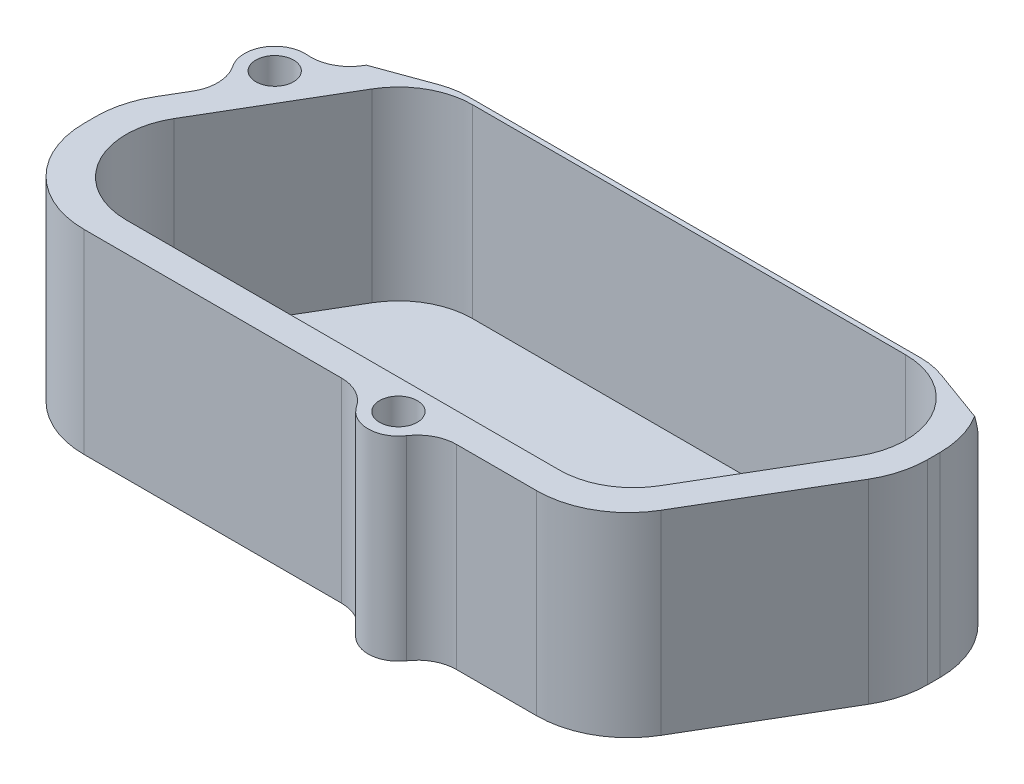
SolidWorks part; units mm, degrees
ref_plane "Front Plane" through (0, 0, 0) normal (0, 0, 1) x (1, 0, 0)
ref_plane "Top Plane" through (0, 0, 0) normal (0, 1, 0) x (1, 0, 0)
ref_plane "Right Plane" through (0, 0, 0) normal (1, 0, 0) x (0, 0, -1)
sketch "Sketch1" plane through (0, 0, 0) normal (0, 1, 0) x (1, 0, 0)
  line L0 (-28.2141, 0) -> (28.2141, 0)
  line L1 (36.5344, 4.7598) -> (46.0926, 21.0158)
  line L2 (-32.3971, 29.0976) -> (-30.1984, 32.837)
  line L3 (51.0344, 26.7749) -> (51.0344, 25.1592)
  line L4 (29.0733, -3.81) -> (15.0701, -3.81)
  line L5 (-41.8495, 9.7658) -> (-41.8495, 8.1501)
  line L6 (7.1972, -3.81) -> (-29.8894, -3.81)
  line L7 (39.3833, 2.088) -> (49.3843, 19.0971)
  line L11 (-40.1994, 15.8279) -> (-36.192, 22.6435)
  line L16 (-36.5344, 14.5442) -> (-26.9762, 30.8002)
  line L19 (-18.6559, 35.56) -> (37.7723, 35.56)
  line L23 (-19.8884, 38.735) -> (39.0743, 38.735)
  arc A0 (47.4239, 25.9953) -> (46.0926, 21.0158) centre (37.7723, 25.908) cw
  arc A1 (-37.8661, 9.652) -> (-36.5344, 14.5442) centre (-28.2141, 9.652) cw
  arc A2 (37.7723, 35.56) -> (47.4239, 25.9953) centre (37.7723, 25.908) cw
  arc A3 (-26.9762, 30.8002) -> (-18.6559, 35.56) centre (-18.6559, 25.908) cw
  arc A4 (36.5344, 4.7598) -> (28.2141, 0) centre (28.2141, 9.652) cw
  arc A5 (-37.8661, 9.652) -> (-28.2141, 0) centre (-28.2141, 9.652) ccw
  arc A6 (39.0743, 38.735) -> (51.0344, 26.7749) centre (39.0743, 26.7749) cw
  arc A7 (51.0344, 25.1592) -> (49.3843, 19.0971) centre (39.0743, 25.1592) cw
  arc A8 (39.3833, 2.088) -> (29.0733, -3.81) centre (29.0733, 8.1501) cw
  arc A9 (-29.8894, -3.81) -> (-41.8495, 8.1501) centre (-29.8894, 8.1501) cw
  arc A10 (-41.8495, 9.7658) -> (-40.1994, 15.8279) centre (-29.8894, 9.7658) cw
  arc A11 (-30.1984, 32.837) -> (-19.8884, 38.735) centre (-19.8884, 26.7749) cw
  circle A12 centre (11.1337, -3.8772) radius 2.0828 construction
  arc A14 (-32.3971, 29.0976) -> (-36.192, 22.6435) centre (-35.3452, 26.4883) ccw
  circle A15 centre (-35.3452, 26.4883) radius 2.0828 construction
  arc A16 (7.1972, -3.81) -> (15.0701, -3.81) centre (11.1337, -3.8772) ccw
  point P11 (47.4757, 23.368)
  point P18 (-37.8661, 12.192)
  point P35 (-37.8661, 0)
  point P45 (0, 0)
  dimension "D7" = 3.175
  dimension "D6" = 1.6157
  dimension "D11" = 9.652
  dimension "D12" = 0.7439
  dimension "D13" = 1.6157
  dimension "D14" = 3.937
  dimension "D2" = 67.9468
  dimension "D3" = 3.81
  dimension "D4" = 35.56
  dimension "D5" = 3.81
  dimension "D8" = 3.81
  dimension "D9" = 12.192
  dimension "D10" = 120.455
extrude "Boss-Extrude1" add sketch "Sketch1" along normal blind 25.4
hole_wizard "#10 (0.1935) Diameter Hole1" positions "Sketch2" profile "Sketch3" hole size "#10" standard "ANSI Inch"
sketch "Sketch2" plane through (0, 25.4, 0) normal (0, 1, 0) x (1, 0, 0)
  point P0 (-35.3452, 26.4883)
  point P3 (11.1337, -3.8772)
sketch "Sketch3" plane through (-35.3452, 25.4, -26.4883) normal (1, 0, 0) x (0, 0, 1)
  line L0 (0, 0) -> (0, 25.4)
  line L1 (0, 25.4) -> (2.4574, 25.4)
  line L2 (2.4574, 25.4) -> (2.4574, 0)
  line L5 (2.4574, 0) -> (0, 0)
  line L11 (0, -6.35) -> (0, 107.95) construction
  dimension "Thru Hole Dia." = 4.9149
  dimension "Thru Hole Depth" = 25.4
fillet "Fillet3" radius 5.08 4 edges at (15.0701, 12.7, 3.81) (7.1972, 12.7, 3.81) (-32.3971, 12.7, -29.0976) (-36.192, 12.7, -22.6435)
sketch "Sketch4" plane through (0, 25.4, 0) normal (0, 1, 0) x (1, 0, 0)
  line L0 (-23.979, 38.0137) -> (-35.9131, 33.6701)
  line L2 (43.1649, 38.0137) -> (55.099, 33.6701)
  line L3 (39.0743, 38.735) -> (-19.8884, 38.735)
  line L4 (39.0743, 38.735) -> (-19.8884, 38.735)
  arc A6 (51.0344, 26.7749) -> (39.0743, 38.735) centre (39.0743, 26.7749) ccw
  arc A7 (-19.8884, 38.735) -> (-30.1744, 32.8775) centre (-19.8884, 26.7749) ccw
  arc A8 (43.1649, 38.0137) -> (39.0743, 38.735) centre (39.0743, 26.7749) ccw
  arc A9 (-19.8884, 38.735) -> (-23.979, 38.0137) centre (-19.8884, 26.7749) ccw
  point P9 (-25.8251, 37.5287)
  point P10 (0, 0)
  point P11 (0, 0)
  point P12 (0, 0)
  point P14 (0, 0)
  dimension "D2" = 160
  dimension "D3" = 12.7
  dimension "D4" = 160
  dimension "D5" = 12.7
  dimension "D1" = 0
ref_plane "Plane1" through (55.099, 25.4, -33.6701) normal (-0.9397, 0, -0.342) x (-0.342, 0, 0.9397)
sketch "Sketch5" plane through (62.2552, 25.4, -53.3315) normal (-0.9397, 0, -0.342) x (-0.342, 0, 0.9397)
  line L0 (20.9233, 0) -> (23.4633, 0)
  line L3 (23.4633, 0) -> (20.9233, -6.9786)
  line L4 (20.9233, -6.9786) -> (20.9233, 0)
  point P2 (0, 0)
  point P4 (22.0771, 18.9493)
  point P5 (0, 0)
  point P6 (20.9233, 0)
  dimension "D1" = 2.54
  dimension "D2" = 70
sweep "Cut-Sweep2" cut profiles "Sketch5" path "Sketch4"
sketch "Sketch6" plane through (0, 0, 0) normal (0, -1, 0) x (1, 0, 0)
  line L21 (-26.9762, -30.8002) -> (-36.5344, -14.5442)
  line L22 (37.7723, -35.56) -> (-18.6559, -35.56)
  line L23 (36.5344, -4.7598) -> (46.0926, -21.0158)
  line L24 (-28.2141, 0) -> (28.2141, 0)
  line L25 (-26.9762, -30.8002) -> (-36.5344, -14.5442)
  line L26 (37.7723, -35.56) -> (-18.6559, -35.56)
  line L27 (36.5344, -4.7598) -> (46.0926, -21.0158)
  line L28 (-28.2141, 0) -> (28.2141, 0)
  arc A14 (-28.2141, 0) -> (-36.5344, -14.5442) centre (-28.2141, -9.652) ccw
  arc A15 (-26.9762, -30.8002) -> (-18.6559, -35.56) centre (-18.6559, -25.908) ccw
  arc A16 (37.7723, -35.56) -> (46.0926, -21.0158) centre (37.7723, -25.908) ccw
  arc A17 (36.5344, -4.7598) -> (28.2141, 0) centre (28.2141, -9.652) ccw
  arc A18 (-26.9762, -30.8002) -> (-18.6559, -35.56) centre (-18.6559, -25.908) ccw
  arc A19 (37.7723, -35.56) -> (46.0926, -21.0158) centre (37.7723, -25.908) ccw
  arc A20 (36.5344, -4.7598) -> (28.2141, 0) centre (28.2141, -9.652) ccw
  arc A21 (-28.2141, 0) -> (-36.5344, -14.5442) centre (-28.2141, -9.652) ccw
  dimension "D1" = 0
  dimension "D2" = 0
extrude "Boss-Extrude2" add sketch "Sketch6" against normal blind 1.27
